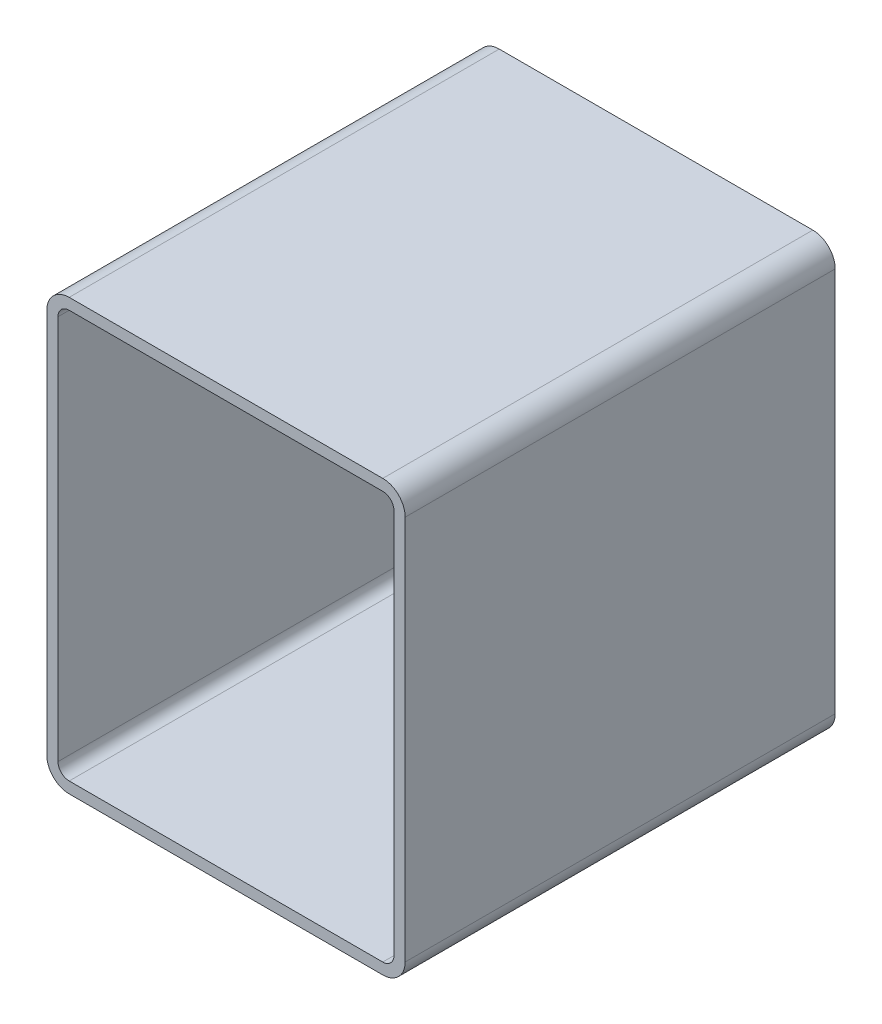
SolidWorks part; units mm, degrees
ref_plane "Front Plane" through (0, 0, 0) normal (0, 0, 1) x (1, 0, 0)
ref_plane "Top Plane" through (0, 0, 0) normal (0, 1, 0) x (1, 0, 0)
ref_plane "Right Plane" through (0, 0, 0) normal (1, 0, 0) x (0, 0, -1)
sketch "Sketch1" plane through (0, 0, 0) normal (0, 0, 1) x (1, 0, 0)
sketch_block_instance "HSS12x10x0.3125-1"
sketch_block "HSS12x10x0.3125"
extrude "Boss-Extrude1" add sketch "Sketch1" along normal blind 304.8
